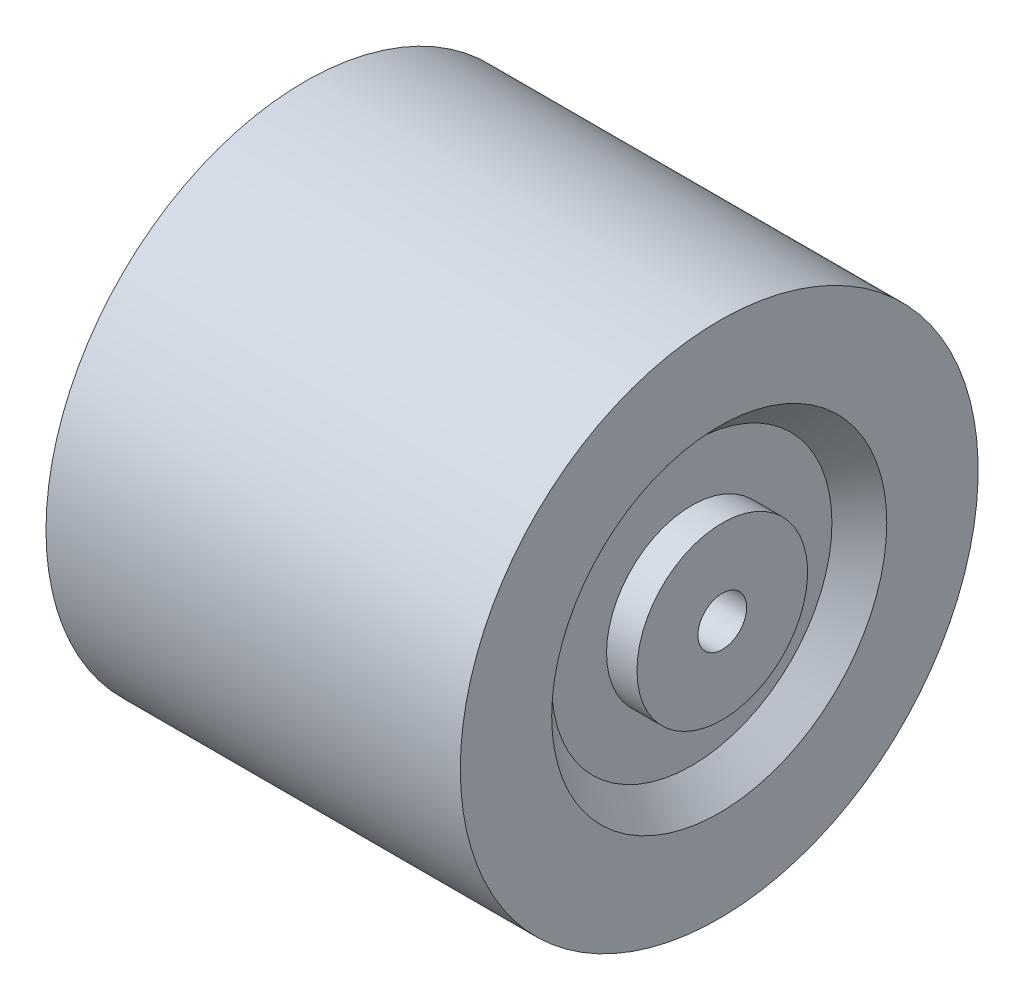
SolidWorks part; units mm, degrees
ref_plane "Face" through (0, 0, 0) normal (0, 0, 1) x (1, 0, 0)
ref_plane "Dessus" through (0, 0, 0) normal (0, 1, 0) x (1, 0, 0)
ref_plane "Droite" through (0, 0, 0) normal (1, 0, 0) x (0, 0, -1)
sketch "Esquisse1" plane through (0, 0, 0) normal (0, 0, 1) x (1, 0, 0)
  line L0 (34.5, 4) -> (34.5, 14)
  line L1 (34.5, 14) -> (29.5, 14)
  line L2 (29.5, 14) -> (29.5, 23)
  line L3 (29.5, 23) -> (34, 27.5)
  line L4 (34, 27.5) -> (34, 42.5)
  line L6 (34, 42.5) -> (0, 42.5)
  line L7 (0, 42.5) -> (0, 4)
  line L8 (0, 4) -> (34.5, 4)
  line L9 (0, 0) -> (50, 0) construction
  dimension "D1" = 4
  dimension "D2" = 14
  dimension "D3" = 23
  dimension "D4" = 27.5
  dimension "D6" = 42.5
  dimension "D8" = 4.5
  dimension "D9" = 34.5
  dimension "D10" = 5
revolve "Base-Révolution" add sketch "Esquisse1" angle 360 about L9
mirror "Symétrie1" about plane through (0, 0, 0) normal (1, 0, 0)
